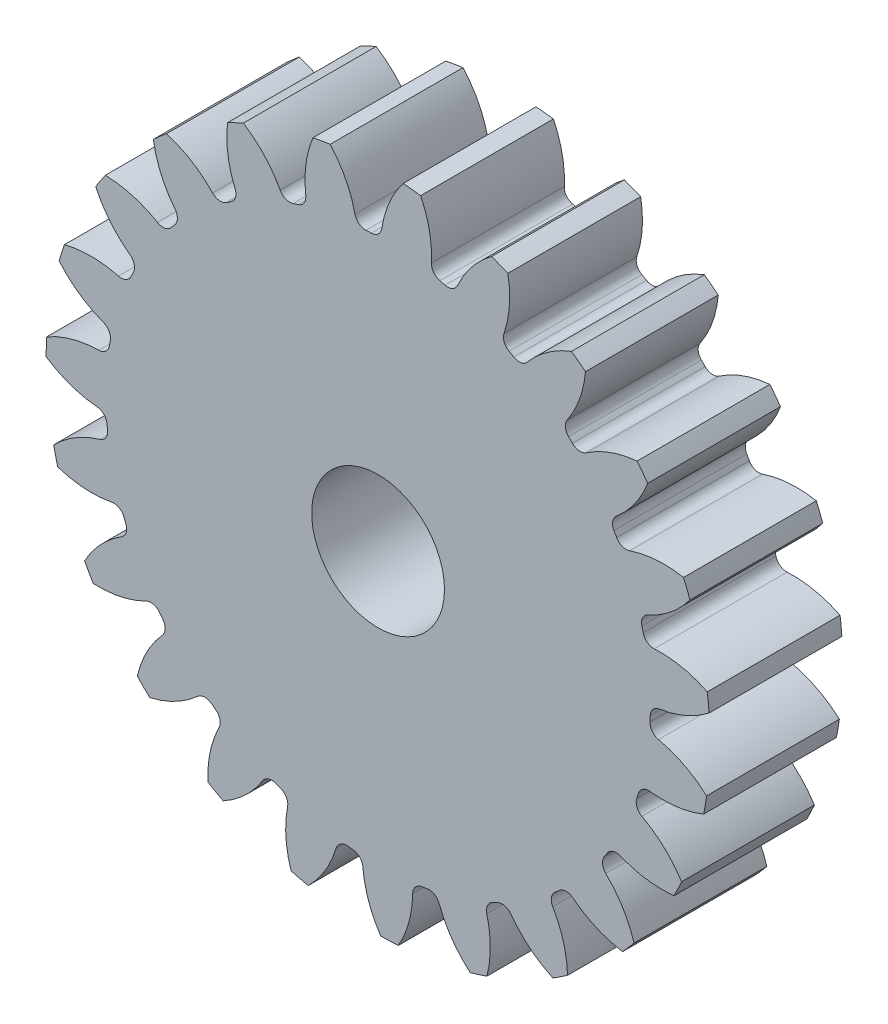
SolidWorks part; units mm, degrees
ref_plane "Front" through (0, 0, 0) normal (0, 0, 1) x (1, 0, 0)
ref_plane "Top" through (0, 0, 0) normal (0, 1, 0) x (1, 0, 0)
ref_plane "Right" through (0, 0, 0) normal (1, 0, 0) x (0, 0, -1)
sketch "Sketch3" plane through (0, 0, 0) normal (0, 0, 1) x (1, 0, 0)
  circle A0 centre (0, 0) radius 254
  dimension "od" = 508
extrude "gearBody" add sketch "Sketch3" along normal blind 101.6
sketch "Sketch2" plane through (0, 0, 0) normal (0, 0, 1) x (1, 0, 0)
  line L0 (0, 0) -> (202.8723, 84.0324) construction
  line L1 (252.0736, -37.0637) -> (0, 0) construction
  line L2 (0, 0) -> (36.3143, 0) construction
  line L3 (233.5422, 8.0238) -> (232.4686, -23.7637) construction
  line L5 (233.0054, -7.87) -> (0, 0) construction
  line L7 (0, 0) -> (219.5874, 0) construction
  arc A0 (219.5547, 3.785) -> (218.799, -18.5908) centre (0, 0) ccw construction
  arc A1 (253.2591, 19.3862) -> (251.3738, -36.4307) centre (0, 0) ccw construction
  arc A2 (233.5422, 8.0238) -> (232.4686, -23.7637) centre (0, 0) ccw construction
  arc A3 (208.0815, -9.0907) -> (208.2207, -4.9704) centre (0, 0) ccw
  arc A4 (252.0736, -37.0637) -> (214.5471, -17.5243) centre (196.7398, -97.5297) ccw
  arc A5 (252.0736, -37.0637) -> (254, 19.9706) centre (0, 0) ccw
  arc A6 (254, 19.9706) -> (215.2406, 3.0078) centre (202.8723, 84.0324) cw
  arc A7 (208.2207, -4.9704) -> (215.2406, 3.0078) centre (216.4886, -5.1677) cw
  arc A8 (214.5471, -17.5243) -> (208.0815, -9.0907) centre (216.3439, -9.4516) cw
  point P6 (254, 19.9706)
  point P22 (252.0736, -37.0637)
  dimension "baseDia" = 439.1747
  dimension "od" = 508
  dimension "pd" = 467.36
  dimension "rd" = 416.56
  dimension "rFillet" = 8.2702
  dimension "pointX" = 254
  dimension "pointY" = 19.9706
  dimension "CTT" = 31.7875
  dimension "flankCenterAngle" = 22.5
extrude "toothCut" cut sketch "Sketch2" along normal through all
pattern_circular "CirPattern1" count 23 over 360 about axis through (0, 0, 0) along (0, 0, 1) of "toothCut"
sketch "hub1Dia" plane through (0, 0, 0) normal (0, 0, -1) x (-1, 0, 0)
  circle A0 centre (0, 0) radius 12.7
  dimension "hub1Dia" = 25.4
sketch "hub2Dia" plane through (0, 0, 101.6) normal (0, 0, 1) x (1, 0, 0)
  circle A0 centre (0, 0) radius 12.7
  dimension "hub2dia" = 25.4
sketch "boreDia" plane through (0, 0, 0) normal (0, 0, 1) x (1, 0, 0)
  circle A0 centre (0, 0) radius 50.8
  dimension "boreDia" = 101.6
extrude "bore" cut sketch "boreDia" against normal mid plane 25400
